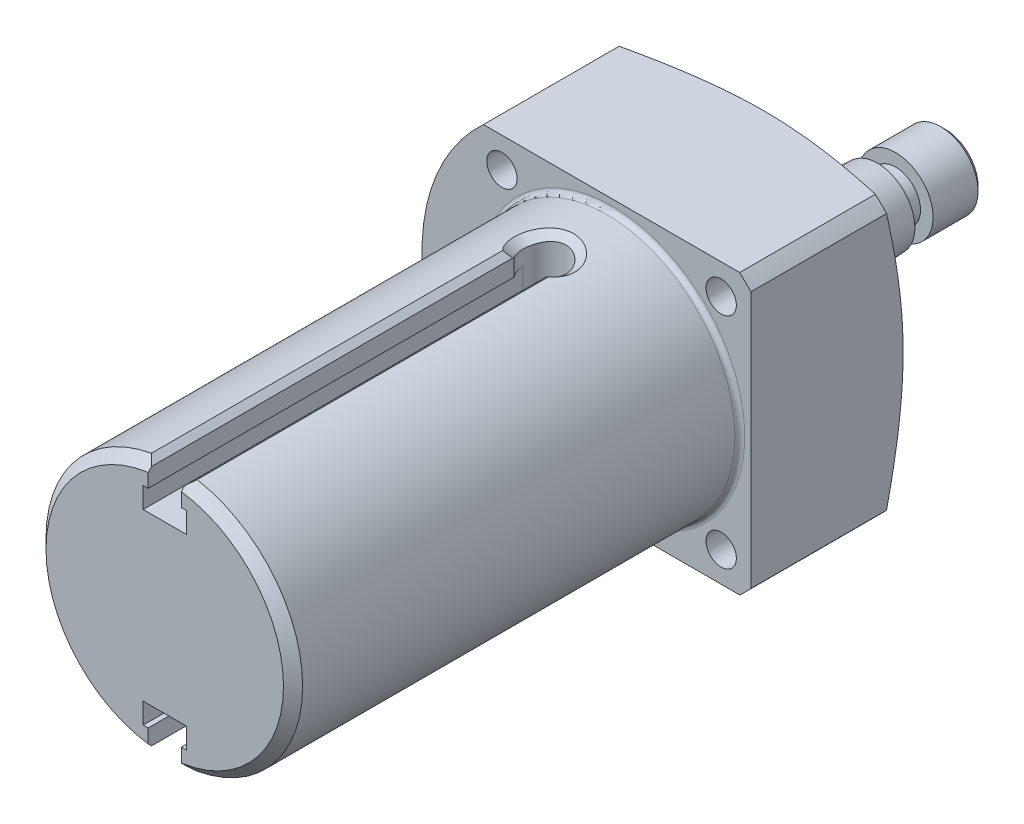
SolidWorks part; units mm, degrees
ref_plane "Front Plane" through (0, 0, 0) normal (0, 0, 1) x (1, 0, 0)
ref_plane "Top Plane" through (0, 0, 0) normal (0, 1, 0) x (1, 0, 0)
ref_plane "Right Plane" through (0, 0, 0) normal (1, 0, 0) x (0, 0, -1)
sketch "Sketch1" plane through (0, 0, 0) normal (0, 0, 1) x (1, 0, 0)
  line L0 (0, 0) -> (62.0084, 0) construction
  line L1 (-20.3918, 22.225) -> (20.3918, 22.225)
  line L2 (22.1742, 20.447) -> (22.1742, -20.447)
  line L3 (-20.3918, -22.225) -> (20.3918, -22.225)
  arc A0 (-20.3918, 22.225) -> (-20.3918, -22.225) centre (0, 0) ccw
  arc A1 (22.1742, 20.447) -> (20.3918, 22.225) centre (0, 0) ccw
  arc A2 (20.3918, -22.225) -> (22.1742, -20.447) centre (0, 0) ccw
  dimension "D1" = 60.325
  dimension "D2" = 44.45
  dimension "D3" = 22.1742
extrude "Extrude1" add sketch "Sketch1" along normal blind 99.314
sketch "Sketch2" plane through (0, 0, 0) normal (0, 1, 0) x (1, 0, 0)
  line L0 (0, 0) -> (0, -96.9332) construction
  line L1 (-30.1625, -28.194) -> (-20.4216, -28.194)
  line L2 (-30.1625, 0) -> (-30.1625, -99.314) construction
  line L3 (-20.4216, -28.194) -> (-20.4216, -99.314)
  line L5 (-10.16, 0) -> (-30.1625, -6.604)
  line L6 (20.3918, 0) -> (-20.3918, 0) construction
  line L7 (-20.4216, -99.314) -> (-30.1625, -99.314)
  line L8 (-30.1625, -99.314) -> (-30.1625, -28.194)
  line L9 (-30.1625, -6.604) -> (-30.1625, 0)
  line L10 (-20.3918, 0) -> (-30.1625, 0) construction
  line L11 (-30.1625, 0) -> (-10.16, 0)
  dimension "D1" = 71.12
  dimension "D2" = 40.8432
  dimension "D5" = 20.32
  dimension "D6" = 6.604
revolve "Cut-Revolve1" cut sketch "Sketch2" angle 360 about L0
sketch "Sketch4" plane through (0, 0, 0) normal (0, 1, 0) x (1, 0, 0)
  line L0 (0, 0) -> (0, -99.9671) construction
  line L1 (6.3437, 0) -> (6.3436, 7.493)
  line L2 (10.16, 0) -> (-10.16, 0) construction
  line L3 (6.3436, 7.493) -> (5.9372, 14.1376)
  line L4 (5.9372, 14.1376) -> (0, 14.1376)
  line L5 (-20.3918, -28.194) -> (20.3918, -28.194) construction
  line L7 (0, 14.1376) -> (0, 0)
  line L8 (0, 0) -> (6.3437, 0)
  dimension "D1" = 3.5
  dimension "D2" = 35.687
  dimension "D4" = 12.6873
  dimension "D5" = 11.8745
  dimension "D6" = 6.6446
revolve "Revolve1" add sketch "Sketch4" angle 360 about L0
hole_wizard "Hole1" positions "Sketch6" profile "Sketch5" legacy
sketch "Sketch6" plane through (0, 0, -14.1376) normal (0, 0, -1) x (-1, 0, 0)
  circle A0 centre (0, 0) radius 5.9372 construction
  point P0 (0, 0)
sketch "Sketch5" plane through (0, 0, -14.1376) normal (1, 0, 0) x (0, 1, 0)
  line L0 (0, 0) -> (0, 21.0111)
  line L1 (0, 21.0111) -> (3.2639, 19.05)
  line L2 (3.2639, 19.05) -> (3.2639, 0)
  line L4 (3.2639, 0) -> (0, 0)
  line L6 (0, 21.0111) -> (-3.2639, 19.05) construction
  line L7 (0, -4.2442) -> (0, 117.3081) construction
  dimension "Diameter" = 6.5278
  dimension "Depth" = 19.05
  dimension "Drill Angle" = 118
hole_wizard "Hole2" positions "Sketch10" profile "Sketch9" legacy
sketch "Sketch10" plane through (4.4648, 0.3939, 0) normal (0, 0, 1) x (1, 0, 0)
  line L1 (-4.4648, -0.3939) -> (19.5659, -0.3939) construction
  line L2 (-4.4648, -0.3939) -> (12.9838, 17.0548) construction
  circle A0 centre (-4.4648, -0.3939) radius 24.6761 construction
  point P0 (12.9838, 17.0548)
  dimension "D2" = 49.3522
  dimension "D1" = 45
sketch "Sketch9" plane through (17.4486, 17.4486, 0) normal (1, 0, 0) x (0, 1, 0)
  line L0 (0, 0) -> (0, 28.195)
  line L1 (0, 28.195) -> (2.413, 28.195)
  line L2 (2.413, 28.195) -> (2.413, 10.1092)
  line L3 (2.413, 10.1092) -> (3.9624, 10.1092)
  line L4 (3.9624, 10.1092) -> (3.9624, 0)
  line L5 (3.9624, 0) -> (0, 0)
  line L6 (0, 110) -> (0, -10) construction
  dimension "Diameter" = 4.826
  dimension "Depth" = 28.195
  dimension "C-Bore Diameter" = 7.9248
  dimension "C-Bore Depth" = 10.1092
pattern_circular "CirPattern1" count 4 over 360 about axis through (0, 0, 0) along (0, 0, 1) of "Hole2"
ref_plane "Plane1" through (0, 0, 20.2692) normal (0, 0, 1) x (1, 0, 0)
sketch "Sketch11" plane through (0, 0, 20.2692) normal (0, 0, 1) x (1, 0, 0)
  line L0 (0, 0) -> (19.628, -9.1527) construction
  line L1 (0, 0) -> (27.0444, 0) construction
  line L2 (-66.5739, 26.4477) -> (-20.5334, 4.9787)
  line L3 (-20.5334, 4.9787) -> (-18.773, 8.754)
  line L4 (-18.773, 8.754) -> (-64.8134, 30.223)
  line L5 (-64.8134, 30.223) -> (-66.5739, 26.4477)
  dimension "D1" = 25
  dimension "D2" = 20.7137
  dimension "D3" = 8.3312
  dimension "D4" = 50.8
revolve "Cut-Revolve2" cut sketch "Sketch11" angle 360 about L0
mirror "Mirror1" about plane through (0, 0, 0) normal (0, 1, 0) of "Cut-Revolve2"
sketch "Sketch12" plane through (0, 0, 99.314) normal (0, 0, 1) x (1, 0, 0)
  line L0 (0, 0) -> (0, 26.7352) construction
  line L1 (-2.6416, 50.8) -> (-2.6416, 16.51)
  line L2 (-2.6416, 16.51) -> (-3.429, 16.51)
  line L3 (-3.429, 16.51) -> (-3.429, 13.208)
  line L4 (-3.429, 13.208) -> (3.429, 13.208)
  line L5 (3.429, 16.51) -> (3.429, 13.208)
  line L6 (2.6416, 16.51) -> (3.429, 16.51)
  line L7 (2.6416, 50.8) -> (2.6416, 16.51)
  line L8 (-2.6416, 50.8) -> (2.6416, 50.8)
  dimension "D1" = 5.2832
  dimension "D2" = 6.858
  dimension "D3" = 3.302
  dimension "D4" = 13.208
  dimension "D5" = 50.8
extrude "Cut-Extrude1" cut sketch "Sketch12" against normal blind 60.452
sketch "Sketch13" plane through (0, 0, 99.314) normal (0, 0, 1) x (1, 0, 0)
  line L0 (0, 0) -> (32.0428, 0) construction
  line L1 (0, 0) -> (0, -27.5102) construction
  line L2 (-3.429, -13.208) -> (3.429, -13.208)
  line L3 (3.429, -13.208) -> (3.429, -16.51)
  line L4 (3.429, -16.51) -> (2.6416, -16.51)
  line L5 (2.6416, -16.51) -> (2.6416, -50.8)
  line L6 (2.6416, -50.8) -> (-2.6416, -50.8)
  line L7 (-3.429, 13.208) -> (3.429, 13.208) construction
  line L8 (3.429, 16.51) -> (3.429, 13.208) construction
  line L9 (2.6416, 50.8) -> (2.6416, 16.51) construction
  line L10 (-2.6416, -16.51) -> (-2.6416, -50.8)
  line L11 (-3.429, -16.51) -> (-2.6416, -16.51)
  line L12 (-3.429, -13.208) -> (-3.429, -16.51)
extrude "Cut-Extrude2" cut sketch "Sketch13" against normal blind 44.704
sketch "Sketch14" plane through (0, 22.225, 0) normal (0, 1, 0) x (1, 0, 0)
  line L0 (-2.6416, -38.862) -> (2.6416, -38.862) construction
  circle A0 centre (0, -38.862) radius 3.429
  dimension "D1" = 3.429
extrude "Cut-Extrude3" cut sketch "Sketch14" against normal up to surface (9.017 mm away)
sketch "Sketch15" plane through (0, -22.225, 0) normal (0, -1, 0) x (1, 0, 0)
  line L0 (3.429, 54.61) -> (-3.429, 54.61) construction
  circle A0 centre (0, 54.61) radius 3.429
  dimension "D1" = 3.429
extrude "Cut-Extrude4" cut sketch "Sketch15" against normal up to surface (9.017 mm away)
sketch "Sketch16" plane through (0, 0, 0) normal (0, 1, 0) x (1, 0, 0)
  line L0 (0, 0) -> (0, -122.9241) construction
  line L1 (3.9624, 14.1376) -> (3.9624, 17.018)
  line L2 (5.9372, 14.1376) -> (-5.9372, 14.1376) construction
  line L3 (3.9624, 17.018) -> (5.9563, 17.018)
  line L4 (5.9563, 17.018) -> (5.9563, 24.1808)
  line L5 (5.9563, 24.1808) -> (5.1943, 24.9428)
  line L6 (5.1943, 24.9428) -> (0, 24.9428)
  line L7 (0, 24.9428) -> (0, 14.1376)
  line L8 (0, 14.1376) -> (3.9624, 14.1376)
  line L9 (-6.3436, 7.493) -> (6.3436, 7.493) construction
  dimension "D1" = 7.9248
  dimension "D2" = 9.525
  dimension "D3" = 11.9126
  dimension "D4" = 7.9248
  dimension "D5" = 45
  dimension "D6" = 10.3886
revolve "Revolve2" add sketch "Sketch16" angle 360 about L0
sketch "Sketch17" plane through (0, 0, -24.9428) normal (0, 0, -1) x (-1, 0, 0)
  line L1 (3.175, -1.8331) -> (3.175, 1.8331)
  line L2 (3.175, 1.8331) -> (0, 3.6662)
  line L3 (0, 3.6662) -> (-3.175, 1.8331)
  line L4 (-3.175, 1.8331) -> (-3.175, -1.8331)
  line L5 (-3.175, -1.8331) -> (0, -3.6662)
  line L6 (0, -3.6662) -> (3.175, -1.8331)
  circle A0 centre (0, 0) radius 3.175 construction
  dimension "D1" = 6.35
extrude "Cut-Extrude5" cut sketch "Sketch17" against normal blind 4.7498
chamfer "Chamfer1" distance 1.524 angle 45 2 edges at (-20.4216, 0, 99.314) (20.4216, 0, 99.314)
fillet "Fillet1" radius 0.7874 1 edges at (-20.4216, 0, 28.194)
chamfer "Chamfer2" distance 0.9906 angle 50.05 6 edges at (2.6416, -20.25, 77.2932) (-0.4071, -20.4175, 58.0147) (-2.6416, -20.25, 77.2932) (-2.6416, 20.25, 69.4192) (-0.4071, 20.4175, 35.4573) (2.6416, 20.25, 69.4192)
